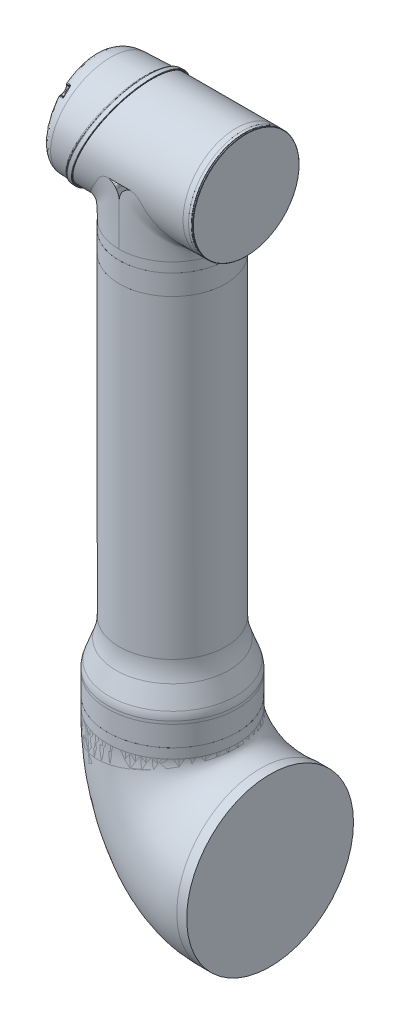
SolidWorks part; units mm, degrees
ref_plane "前视基准面" through (0, 0, 0) normal (0, 0, 1) x (1, 0, 0)
ref_plane "上视基准面" through (0, 0, 0) normal (0, 1, 0) x (1, 0, 0)
ref_plane "右视基准面" through (0, 0, 0) normal (1, 0, 0) x (0, 0, -1)
imported_body "C25下臂-1-solid1"
imported_body "C25下臂-1-solid2"
imported_body "C25下臂-1-solid3"
imported_body "C25下臂-1-solid4"
imported_body "C25下臂-1-solid5"
imported_body "C25下臂-1-solid6"
imported_body "C25下臂-1-surface1"
imported_body "CS625-J4-1-solid1"
imported_body "CS625-J4-1-solid2"
imported_body "CS625-J4-1-solid3"
imported_body "CS625-J4-1-solid4"
imported_body "CS625-J4-1-solid5"
imported_body "CS625-J4-1-solid6"
imported_body "CS625-J4-1-solid7"
imported_body "CS625-J4-1-solid8"
imported_body "CS625-J4-1-solid9"
imported_body "CS625-J4-1-solid10"
imported_body "CS625-J4-1-solid11"
imported_body "CS625-J4-1-solid12"
split "分割1" trim tools "上视基准面" bodies to split 110 resulting bodies 125 126
other "移动面1" parameters "D1"=100
move or copy body "实体-移动/复制1" bodies to move or copy 127 121 108 124 117 122 116 120 113 114 118 123 109 115 119 copy no translate (0, -100, 0)
combine bodies "组合1" operation type add bodies to combine 128 126
